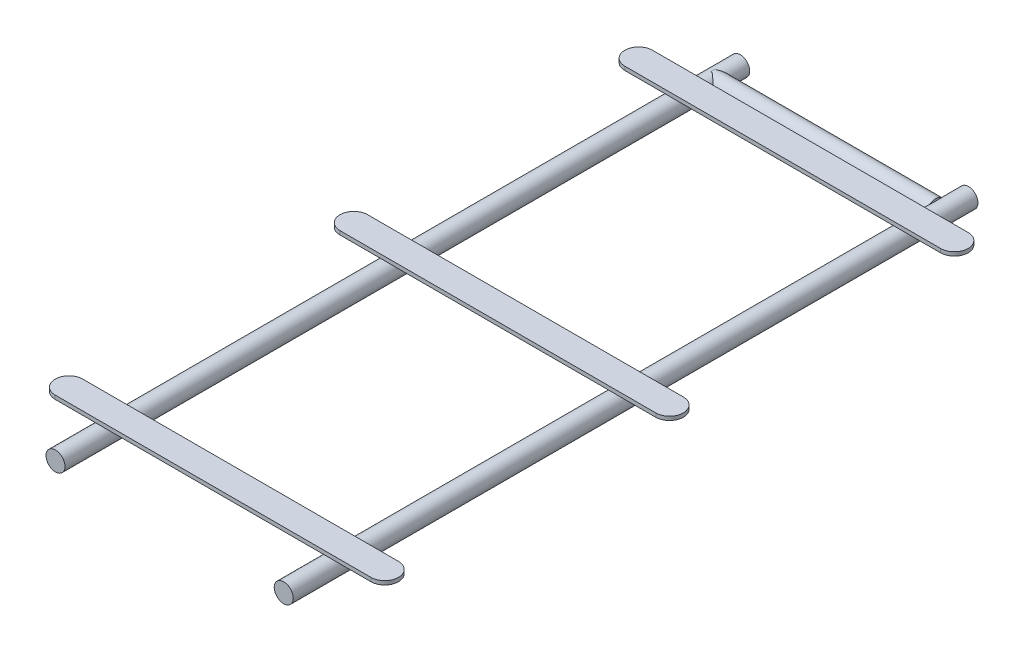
SolidWorks part; units mm, degrees
ref_plane "Front Plane" through (0, 0, 0) normal (0, 0, 1) x (1, 0, 0)
ref_plane "Top Plane" through (0, 0, 0) normal (0, 1, 0) x (1, 0, 0)
ref_plane "Right Plane" through (0, 0, 0) normal (1, 0, 0) x (0, 0, -1)
sketch "Sketch1" plane through (0, 0, 0) normal (0, 0, 1) x (1, 0, 0)
  circle A0 centre (0, 0) radius 2.5
  circle A1 centre (60, 0) radius 2.5
  dimension "D1" = 5
  dimension "D2" = 5
  dimension "D3" = 60
extrude "Boss-Extrude1" add sketch "Sketch1" against normal blind 180
sketch "Sketch2" plane through (0, 0, 0) normal (0, 1, 0) x (1, 0, 0)
  line L0 (-11.5, 15.1278) -> (71.5, 15.1278) construction
  line L1 (-11.5, 18.7556) -> (71.5, 18.7556)
  line L2 (-11.5, 11.5) -> (71.5, 11.5)
  line L3 (-11.5, 90) -> (71.5, 90) construction
  line L4 (-11.5, 93.6278) -> (71.5, 93.6278)
  line L5 (-11.5, 86.3722) -> (71.5, 86.3722)
  line L6 (-11.5, 164.8722) -> (71.5, 164.8722) construction
  line L7 (-11.5, 168.5) -> (71.5, 168.5)
  line L8 (-11.5, 161.2444) -> (71.5, 161.2444)
  line L9 (57.5, 0) -> (62.5, 0) construction
  line L10 (62.5, 180) -> (57.5, 180) construction
  line L11 (44.495, 161.2444) -> (44.495, 93.6278) construction
  line L12 (16.7266, 86.3722) -> (16.7266, 18.7556) construction
  arc A0 (-11.5, 18.7556) -> (-11.5, 11.5) centre (-11.5, 15.1278) ccw
  arc A1 (71.5, 11.5) -> (71.5, 18.7556) centre (71.5, 15.1278) ccw
  arc A2 (-11.5, 93.6278) -> (-11.5, 86.3722) centre (-11.5, 90) ccw
  arc A3 (71.5, 86.3722) -> (71.5, 93.6278) centre (71.5, 90) ccw
  arc A4 (-11.5, 168.5) -> (-11.5, 161.2444) centre (-11.5, 164.8722) ccw
  arc A5 (71.5, 161.2444) -> (71.5, 168.5) centre (71.5, 164.8722) ccw
  point P2 (30, 15.1278)
  point P12 (30, 90)
  point P19 (30, 164.8722)
  dimension "D1" = 14
  dimension "D2" = 14
  dimension "D3" = 11.5
  dimension "D4" = 11.5
ref_plane "Plane1" through (0, 2.5, 0) normal (0, 1, 0) x (1, 0, 0)
sketch "Sketch6" plane through (0, 2.5, 0) normal (0, 1, 0) x (1, 0, 0)
  line L0 (-11.5563, 15.1027) -> (71.4437, 15.1027) construction
  line L1 (-11.5563, 18.7305) -> (71.4437, 18.7305)
  line L2 (-11.5563, 11.4749) -> (71.4437, 11.4749)
  line L3 (-11.5563, 89.9749) -> (71.4437, 89.9749) construction
  line L4 (-11.5563, 93.6027) -> (71.4437, 93.6027)
  line L5 (-11.5563, 86.3472) -> (71.4437, 86.3472)
  line L6 (-11.5563, 164.8472) -> (71.4437, 164.8472) construction
  line L7 (-11.5563, 168.4749) -> (71.4437, 168.4749)
  line L8 (-11.5563, 161.2194) -> (71.4437, 161.2194)
  line L9 (34.4574, 161.2194) -> (34.4574, 93.6027) construction
  line L10 (16.6703, 86.3472) -> (16.6703, 18.7305) construction
  arc A0 (-11.5563, 18.7305) -> (-11.5563, 11.4749) centre (-11.5563, 15.1027) ccw
  arc A1 (71.4437, 11.4749) -> (71.4437, 18.7305) centre (71.4437, 15.1027) ccw
  arc A2 (-11.5563, 93.6027) -> (-11.5563, 86.3472) centre (-11.5563, 89.9749) ccw
  arc A3 (71.4437, 86.3472) -> (71.4437, 93.6027) centre (71.4437, 89.9749) ccw
  arc A4 (-11.5563, 168.4749) -> (-11.5563, 161.2194) centre (-11.5563, 164.8472) ccw
  arc A5 (71.4437, 161.2194) -> (71.4437, 168.4749) centre (71.4437, 164.8472) ccw
  point P2 (29.9437, 15.1027)
  point P10 (29.9437, 89.9749)
  point P17 (29.9437, 164.8472)
extrude "Boss-Extrude3" add sketch "Sketch6" along normal blind 1 separate body
sketch "Sketch7" plane through (0, 0, 0) normal (1, 0, 0) x (0, 0, -1)
  circle A0 centre (172.8599, 0.0603) radius 2.5
  dimension "D1" = 5
extrude "Boss-Extrude4" add sketch "Sketch7" along normal blind 58.5 separate body
